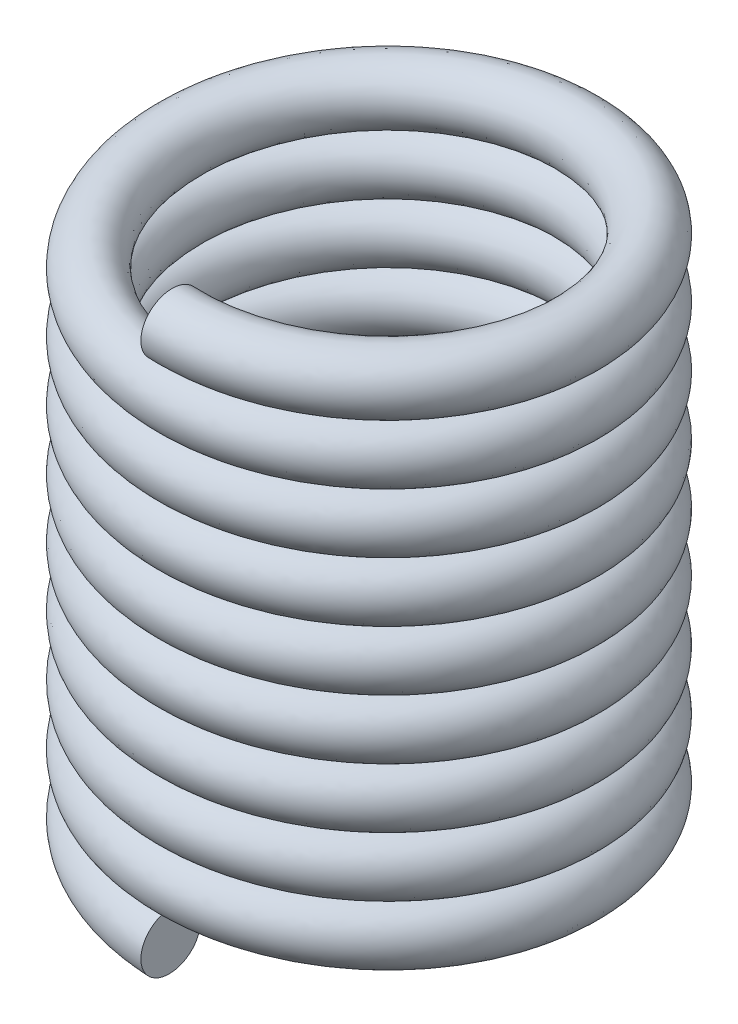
SolidWorks part; units mm, degrees
ref_plane "Front Plane" through (0, 0, 0) normal (0, 0, 1) x (1, 0, 0)
ref_plane "Top Plane" through (0, 0, 0) normal (0, 1, 0) x (1, 0, 0)
ref_plane "Right Plane" through (0, 0, 0) normal (1, 0, 0) x (0, 0, -1)
sketch "Sketch1" plane through (0, 0, 0) normal (0, 1, 0) x (1, 0, 0)
  circle A0 centre (0, 0) radius 10
  dimension "D1" = 20
curve "Helix/Spiral2"
ref_plane "Plane1" through (0, 0, 10) normal (-0.9989, 0.0477, 0) x (0, 0, 1)
sketch "Sketch2" plane through (0, 0, 10) normal (-0.9989, 0.0477, 0) x (0, 0, 1)
  circle A0 centre (0, 0) radius 1.5
  dimension "D1" = 3
sweep "Sweep2" add profiles "Sketch2" path "Helix/Spiral2"
